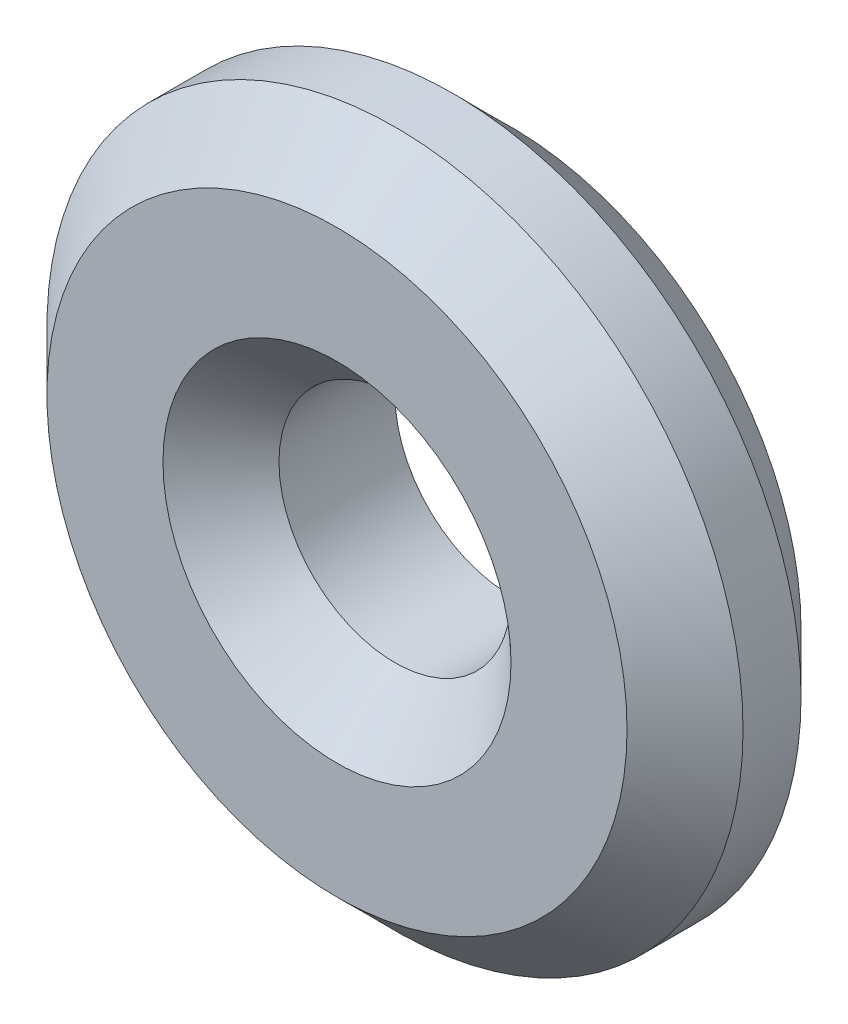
SolidWorks part; units mm, degrees
ref_plane "face" through (0, 0, 0) normal (0, 0, 1) x (1, 0, 0)
ref_plane "dessus" through (0, 0, 0) normal (0, 1, 0) x (1, 0, 0)
ref_plane "profil" through (0, 0, 0) normal (1, 0, 0) x (0, 0, -1)
sketch "Esquisse1" plane through (0, 0, 0) normal (0, 0, 1) x (1, 0, 0)
  circle A0 centre (0, 0) radius 6
  dimension "D1" = 12
extrude "Base-Extrusion" add sketch "Esquisse1" against normal blind 3
chamfer "Chanfrein1" distance 1 angle 45
sketch "Esquisse2" plane through (0, 0, 0) normal (0, 0, 1) x (1, 0, 0)
  circle A0 centre (0, 0) radius 2
  dimension "D1" = 4
extrude "Enlèv. mat.-Extru.1" cut sketch "Esquisse2" against normal through all
chamfer "Chanfrein3" distance 1 angle 45
